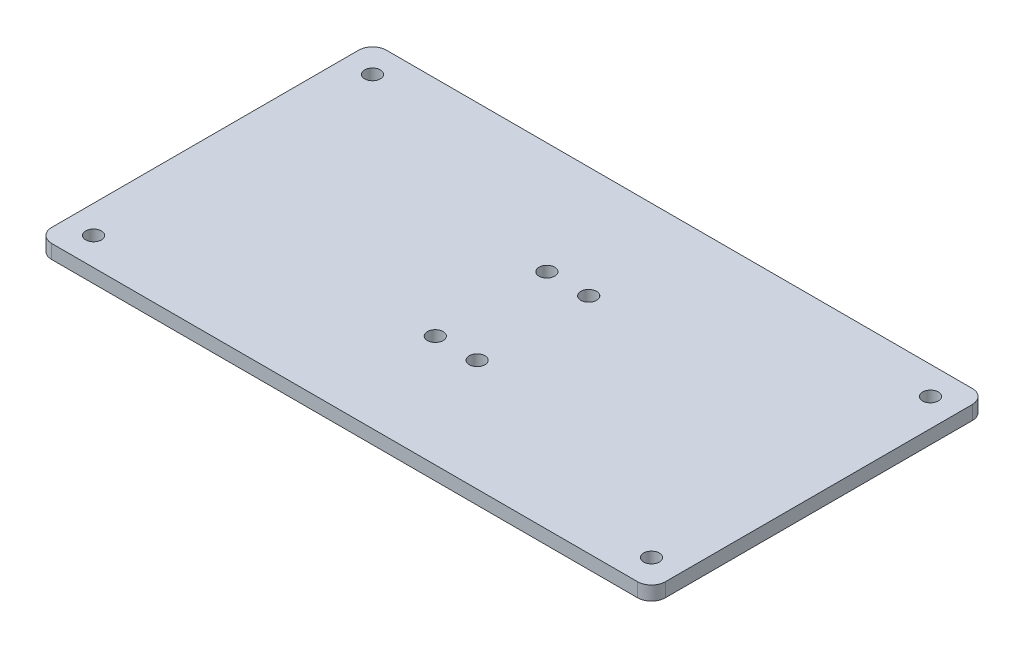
SolidWorks part; units mm, degrees
ref_plane "Front Plane" through (0, 0, 0) normal (0, 0, 1) x (1, 0, 0)
ref_plane "Top Plane" through (0, 0, 0) normal (0, 1, 0) x (1, 0, 0)
ref_plane "Right Plane" through (0, 0, 0) normal (1, 0, 0) x (0, 0, -1)
sketch "Sketch1" plane through (0, 0, 0) normal (0, 1, 0) x (1, 0, 0)
  line L0 (-139.7, 0) -> (139.7, 0) construction
  line L1 (-139.7, -76.2) -> (139.7, -76.2)
  line L2 (-139.7, -76.2) -> (-139.7, 76.2)
  line L3 (-139.7, 76.2) -> (139.7, 76.2)
  line L4 (139.7, -76.2) -> (139.7, 76.2)
  line L5 (-139.7, -76.2) -> (139.7, 76.2) construction
  line L6 (-139.7, 76.2) -> (139.7, -76.2) construction
  line L7 (-127, -63.5) -> (-127, 63.5) construction
  line L8 (-9.525, -25.4) -> (9.525, -25.4) construction
  line L9 (-9.525, -25.4) -> (-9.525, 25.4) construction
  line L10 (-9.525, 25.4) -> (9.525, 25.4) construction
  line L11 (9.525, -25.4) -> (9.525, 25.4) construction
  line L12 (-9.525, -25.4) -> (9.525, 25.4) construction
  line L13 (-9.525, 25.4) -> (9.525, -25.4) construction
  line L14 (-127, 63.5) -> (127, 63.5) construction
  line L15 (127, -63.5) -> (127, 63.5) construction
  line L16 (-127, -63.5) -> (127, -63.5) construction
  circle A0 centre (9.525, 25.4) radius 3.5719
  circle A1 centre (-9.525, 25.4) radius 3.5719
  circle A2 centre (-9.525, -25.4) radius 3.5719
  circle A3 centre (9.525, -25.4) radius 3.5719
  circle A4 centre (-127, 63.5) radius 3.5719
  circle A5 centre (127, 63.5) radius 3.5719
  circle A6 centre (127, -63.5) radius 3.5719
  circle A7 centre (-127, -63.5) radius 3.5719
  point P0 (0, 0)
  point P8 (0, 0)
  dimension "D5" = 7.1437
  dimension "D6" = 7.1437
  dimension "D7" = 7.1437
  dimension "D8" = 7.1437
  dimension "D10" = 7.1437
  dimension "D11" = 7.1437
  dimension "D12" = 7.1437
  dimension "D13" = 7.1437
  dimension "D1" = 152.4
  dimension "D2" = 279.4
  dimension "D3" = 50.8
  dimension "D4" = 19.05
  dimension "D9" = 12.7
extrude "Boss-Extrude1" add sketch "Sketch1" along normal blind 6.35
fillet "Fillet1" radius 6.35 4 edges at (139.7, 3.175, -76.2) (139.7, 3.175, 76.2) (-139.7, 3.175, -76.2) (-139.7, 3.175, 76.2)
